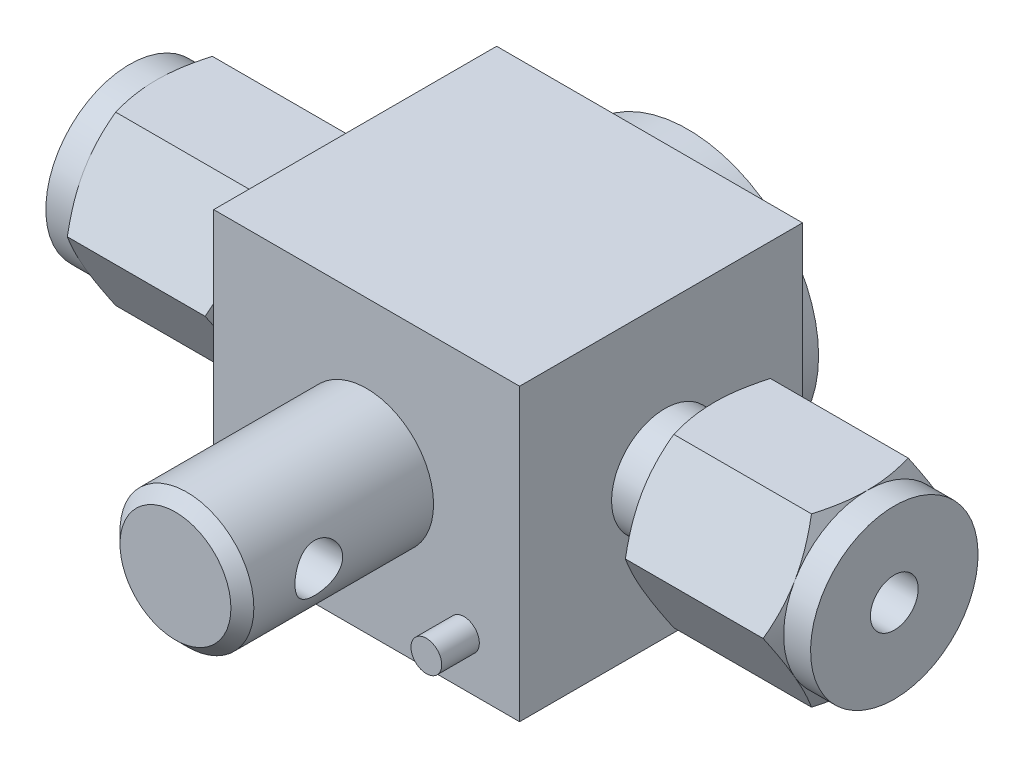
SolidWorks part; units mm, degrees
ref_plane "Front Plane" through (0, 0, 0) normal (0, 0, 1) x (1, 0, 0)
ref_plane "Top Plane" through (0, 0, 0) normal (0, 1, 0) x (1, 0, 0)
ref_plane "Right Plane" through (0, 0, 0) normal (1, 0, 0) x (0, 0, -1)
imported_body "Imported1"
sketch "Sketch1" plane through (0, 0, 9.652) normal (0, 0, -1) x (-1, 0, 0)
  line L1 (18.8226, 15.3672) -> (-63.1964, 15.3672)
  line L2 (18.8226, 15.3672) -> (18.8226, -18.6407)
  line L3 (18.8226, -18.6407) -> (-63.1964, -18.6407)
  line L4 (-63.1964, 15.3672) -> (-63.1964, -18.6407)
extrude "Cut-Extrude1" cut sketch "Sketch1" against normal through all
sketch "Sketch3" plane through (0, 0, 9.652) normal (0, 0, 1) x (1, 0, 0)
  line L0 (15.24, 0) -> (25.4, 0) construction
  line L1 (15.24, 3.5408) -> (15.24, -3.5408) construction
  line L2 (25.4, 0) -> (25.4, 9.652) construction
  line L3 (35.56, 9.652) -> (15.24, 9.652) construction
  circle A0 centre (25.4, 0) radius 4.445
  dimension "D1" = 8.89
extrude "Boss-Extrude1" add sketch "Sketch3" along normal blind 12.7
sketch "Sketch8" plane through (0, 0, 0) normal (1, 0, 0) x (0, 0, -1)
  line L0 (-9.652, 4.445) -> (-9.652, -4.445) construction
  circle A0 centre (-17.272, 0) radius 1.5875
  dimension "D2" = 3.175
  dimension "D1" = 7.62
extrude "Cut-Extrude3" cut sketch "Sketch8" along normal through all
sketch "Sketch7" plane through (0, 0, 9.652) normal (0, 0, 1) x (1, 0, 0)
  line L0 (18.9342, 6.4658) -> (31.8658, -6.4658) construction
  line L1 (16.256, 0) -> (34.544, 0) construction
  circle A0 centre (25.4, 0) radius 9.144 construction
  circle A1 centre (31.8658, -6.4658) radius 1.02
  point P6 (25.4, 0)
  point P9 (25.4, 0)
  dimension "D1" = 18.288
  dimension "D3" = 2.04
  dimension "D2" = 45
extrude "Boss-Extrude2" add sketch "Sketch7" along normal blind 2.5
chamfer "Chamfer1" distance 0.762 angle 45 1 edges at (29.845, 0, 22.352)
